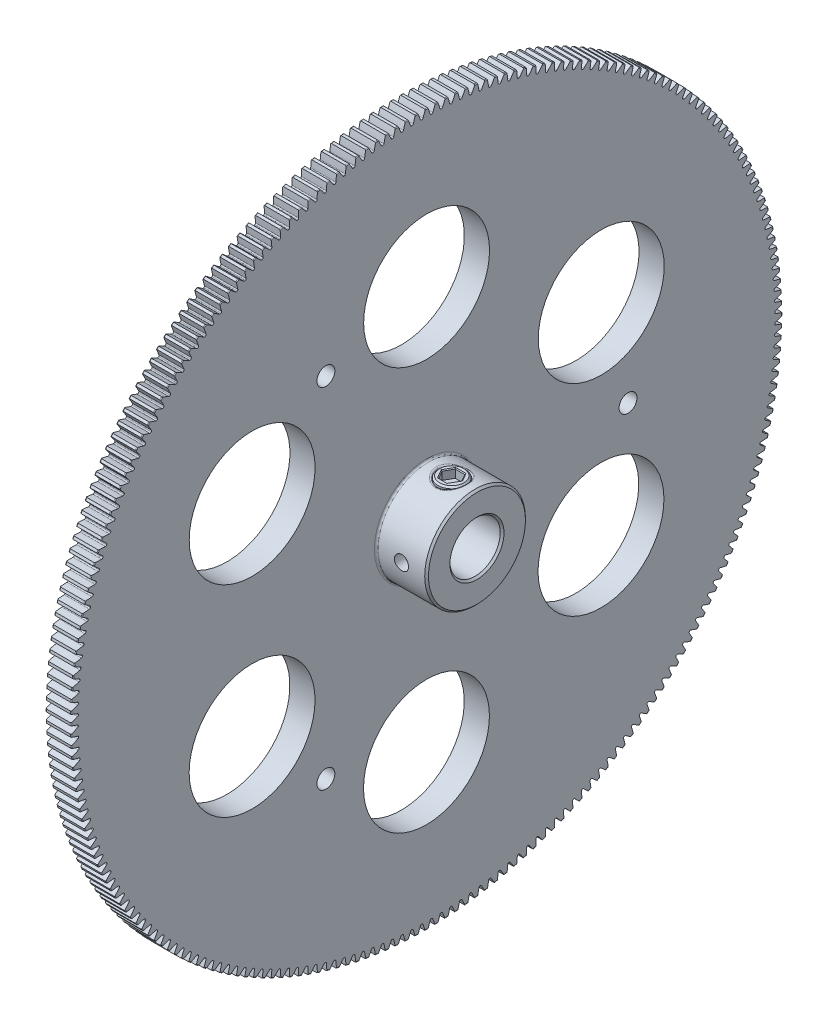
SolidWorks part; units mm, degrees
ref_plane "Front Plane" through (0, 0, 0) normal (0, 0, 1) x (1, 0, 0)
ref_plane "Top Plane" through (0, 0, 0) normal (0, 1, 0) x (1, 0, 0)
ref_plane "Right Plane" through (0, 0, 0) normal (1, 0, 0) x (0, 0, -1)
imported_body "Imported1"
imported_body "Imported2"
sketch "Sketch1" plane through (-1.5875, 0, 0) normal (-1, 0, 0) x (0, 0, 1)
  line L0 (0, 48.2543) -> (0, -51.0435) construction
  line L1 (-51.6014, 0) -> (51.0435, 0) construction
  circle A0 centre (0, 25.4) radius 7.9375
  circle A1 centre (21.997, 12.7) radius 7.9375
  circle A2 centre (22.0047, -12.7) radius 7.9375
  circle A3 centre (0.0153, -25.4133) radius 7.9375
  circle A4 centre (-21.9932, -12.7331) radius 7.9375
  circle A5 centre (-22.0238, 12.6668) radius 7.9375
  dimension "D1" = 15.875
  dimension "D2" = 25.4
  dimension "D4" = 25.4
  dimension "D5" = 25.4
  dimension "D6" = 25.4398
  dimension "D3" = 6
extrude "Cut-Extrude1" cut sketch "Sketch1" against normal through all
sketch "Sketch2" plane through (-1.5875, 0, 0) normal (-1, 0, 0) x (0, 0, 1)
  line L0 (0, 0) -> (12.7, 21.997) construction
  line L1 (0, 25.4) -> (21.997, 12.7) construction
  line L2 (0, 0) -> (12.7, 21.997) construction
  line L3 (0, 0) -> (12.7, -21.997) construction
  circle A0 centre (0, 0) radius 25.4 construction
  circle A1 centre (12.7, 21.997) radius 1.1303
  circle A2 centre (12.7, -21.997) radius 1.1303
  circle A3 centre (-25.4, 0) radius 1.1303
  point P9 (10.9985, 19.05)
  dimension "D1" = 2.2606
  dimension "D3" = 120
  dimension "D4" = 25.4
  dimension "D2" = 3
extrude "Cut-Extrude2" cut sketch "Sketch2" against normal through all
